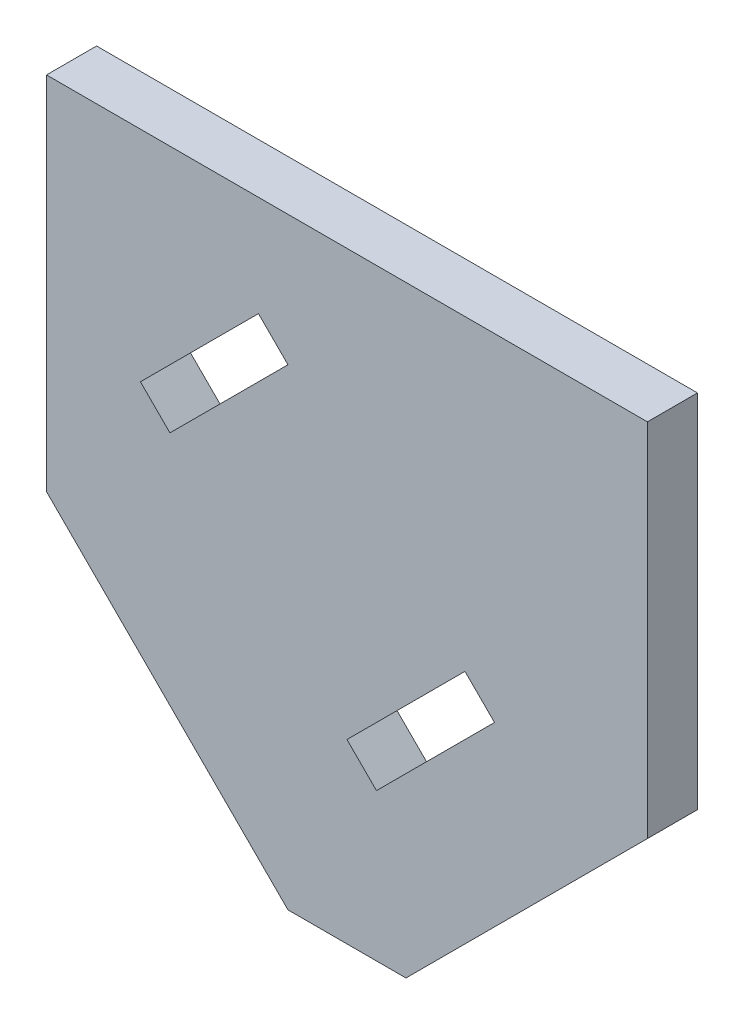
SolidWorks part; units mm, degrees
ref_plane "Front Plane" through (0, 0, 0) normal (0, 0, 1) x (1, 0, 0)
ref_plane "Top Plane" through (0, 0, 0) normal (0, 1, 0) x (1, 0, 0)
ref_plane "Right Plane" through (0, 0, 0) normal (1, 0, 0) x (0, 0, -1)
sketch "Sketch1" plane through (0, 0, 0) normal (0, 0, 1) x (1, 0, 0)
  line L0 (0, 0) -> (0, 35.4714) construction
  line L1 (-18, 21.6256) -> (0, 21.6256)
  line L2 (-0.3, 21.6256) -> (-20, 21.6256) construction
  line L3 (-18, 21.6256) -> (-18, 0)
  line L4 (-20, 0) -> (-0.3, 0) construction
  line L5 (-18, 0) -> (0, -18)
  line L6 (0, -18) -> (18, 0)
  line L7 (18, 0) -> (18, 21.6256)
  line L8 (20, 21.6256) -> (0.3, 21.6256) construction
  line L9 (18, 21.6256) -> (0, 21.6256)
  line L10 (0.3, 0) -> (20, 0) construction
  dimension "D1" = 45
  dimension "D2" = 18
  dimension "D3" = 18
extrude "Boss-Extrude1" add sketch "Sketch1" along normal blind 3
sketch "Sketch2" plane through (0, 0, 3) normal (0, 0, 1) x (1, 0, 0)
  line L4 (8.8388, 1.4454) -> (1.7678, -5.6256)
  line L6 (8.8388, 1.4454) -> (7.0711, 3.2132)
  line L11 (7.0711, 3.2132) -> (0, -3.8579)
  line L12 (0, -3.8579) -> (1.7678, -5.6256)
  line L13 (10.6066, -7.3934) -> (-13.1077, 16.3209) construction
  line L14 (0, -18) -> (18, 0) construction
  line L15 (5.3033, -2.0901) -> (3.5355, -0.3223) construction
  line L16 (-12.3744, 8.5165) -> (-5.3033, 15.5876)
  line L17 (-5.3033, 15.5876) -> (-3.5355, 13.8198)
  line L18 (-3.5355, 13.8198) -> (-10.6066, 6.7487)
  line L19 (-10.6066, 6.7487) -> (-12.3744, 8.5165)
  line L20 (-18, 0) -> (0, -18) construction
  dimension "D1" = 10
  dimension "D2" = 2.5
  dimension "D3" = 7.5
  dimension "D4" = 10
  dimension "D5" = 2.5
  dimension "D6" = 15
  dimension "D7" = 15
extrude "Cut-Extrude1" cut sketch "Sketch2" against normal through all
chamfer "Chamfer1" distance 5 angle 45 1 edges at (0, -18, 1.5)
